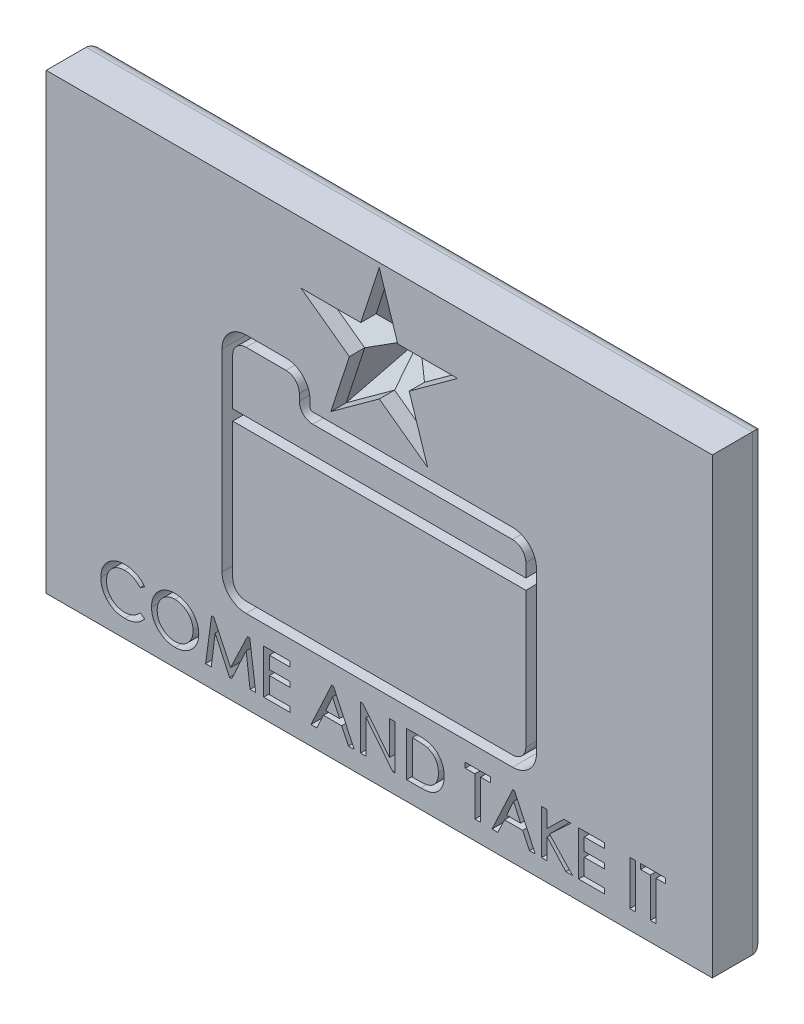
SolidWorks part; units mm, degrees
ref_plane "Front Plane" through (0, 0, 0) normal (0, 0, 1) x (1, 0, 0)
ref_plane "Top Plane" through (0, 0, 0) normal (0, 1, 0) x (1, 0, 0)
ref_plane "Right Plane" through (0, 0, 0) normal (1, 0, 0) x (0, 0, -1)
sketch "Sketch1" plane through (0, 0, 0) normal (0, 0, 1) x (1, 0, 0)
  line L1 (-15.875, -10.795) -> (15.875, -10.795)
  line L2 (-15.875, -10.795) -> (-15.875, 10.795)
  line L3 (-15.875, 10.795) -> (15.875, 10.795)
  line L4 (15.875, -10.795) -> (15.875, 10.795)
  line L5 (-15.875, -10.795) -> (15.875, 10.795) construction
  line L6 (-15.875, 10.795) -> (15.875, -10.795) construction
  point P0 (0, 0)
  dimension "D1" = 31.75
  dimension "D2" = 21.59
extrude "Boss-Extrude1" add sketch "Sketch1" along normal blind 2.54
fillet "Fillet1" radius 0.635 4 edges at (-15.875, 0, 0) (0, -10.795, 0) (0, 10.795, 0) (15.875, 0, 0)
sketch "Sketch2" plane through (0, 0, 2.54) normal (0, 0, 1) x (1, 0, 0)
  line L0 (-15.875, 10.795) -> (-14.977, 9.897) construction
  line L1 (-14.977, 9.897) -> (-14.977, 6.598) construction
  line L2 (-14.977, 6.598) -> (-14.977, 3.299) construction
  line L3 (-14.977, 3.299) -> (-14.977, 0) construction
  line L4 (-14.977, 0) -> (-14.977, -3.299) construction
  line L5 (-14.977, -3.299) -> (-14.977, -6.598) construction
  line L6 (-14.977, -6.598) -> (-14.977, -9.897) construction
  line L7 (-14.977, -9.897) -> (-15.875, -10.795) construction
  line L8 (15.875, 10.795) -> (-15.875, 10.795) construction
  line L9 (-15.875, -10.795) -> (15.875, -10.795) construction
  line L10 (-14.977, -9.897) -> (14.977, -9.897) construction
  line L11 (14.977, -9.897) -> (15.875, -10.795) construction
  line L12 (14.977, -9.897) -> (14.977, -6.598) construction
  line L13 (14.977, -6.598) -> (14.977, -3.299) construction
  line L14 (14.977, -3.299) -> (14.977, 0) construction
  line L15 (14.977, 0) -> (14.977, 3.299) construction
  line L16 (14.977, 3.299) -> (14.977, 6.598) construction
  line L17 (14.977, 6.598) -> (14.977, 9.897) construction
  line L18 (14.977, 9.897) -> (15.875, 10.795) construction
  line L19 (-14.977, 9.897) -> (14.977, 9.897) construction
  line L20 (-14.977, 6.598) -> (14.977, 6.598) construction
  line L21 (-14.977, 3.299) -> (14.977, 3.299) construction
  line L22 (-14.977, 0) -> (14.977, 0) construction
  line L23 (-14.977, -3.299) -> (14.977, -3.299) construction
  line L24 (-14.977, -6.598) -> (14.977, -6.598) construction
  text T0 "<b>COME AND TAKE IT</b>" font "Century Gothic" height in points 8
  dimension "D1" = 45
  dimension "D2" = 45
  dimension "D3" = 1.27
extrude "Cut-Extrude1" cut sketch "Sketch2" against normal blind 1.905
sketch "Sketch3" plane through (0, 0, 2.54) normal (0, 0, 1) x (1, 0, 0)
  line L0 (0, 0) -> (0, -1.905) construction
  line L5 (6.35, 2.54) -> (-3.175, 2.54)
  line L6 (-6.35, -6.35) -> (6.35, -6.35)
  line L7 (-6.985, -5.715) -> (-6.985, 2.54)
  line L9 (6.985, -5.715) -> (6.985, 1.905)
  line L10 (-6.985, -6.35) -> (6.985, 2.54) construction
  line L11 (-6.985, 2.54) -> (6.985, -6.35) construction
  line L12 (-3.81, 3.175) -> (-3.81, 3.4925)
  line L13 (-4.445, 4.1275) -> (-6.35, 4.1275)
  line L14 (-6.985, 3.4925) -> (-6.985, 2.54)
  line L15 (-7.493, -5.715) -> (-7.493, 2.54)
  line L16 (-7.493, 3.4925) -> (-7.493, 2.54)
  line L17 (-4.445, 4.6355) -> (-6.35, 4.6355)
  line L18 (-3.302, 3.175) -> (-3.302, 3.4925)
  line L19 (6.35, 3.048) -> (-3.175, 3.048)
  line L20 (7.493, -5.715) -> (7.493, 1.905)
  line L21 (-6.35, -6.858) -> (6.35, -6.858)
  arc A0 (6.35, 2.54) -> (6.985, 1.905) centre (6.35, 1.905) cw
  arc A1 (6.35, -6.35) -> (6.985, -5.715) centre (6.35, -5.715) ccw
  arc A2 (-6.35, -6.35) -> (-6.985, -5.715) centre (-6.35, -5.715) cw
  arc A3 (-6.35, 4.1275) -> (-6.985, 3.4925) centre (-6.35, 3.4925) ccw
  arc A4 (-3.175, 2.54) -> (-3.81, 3.175) centre (-3.175, 3.175) cw
  arc A5 (-3.81, 3.4925) -> (-4.445, 4.1275) centre (-4.445, 3.4925) ccw
  arc A6 (-6.35, 4.6355) -> (-7.493, 3.4925) centre (-6.35, 3.4925) ccw
  arc A7 (-3.302, 3.4925) -> (-4.445, 4.6355) centre (-4.445, 3.4925) ccw
  arc A8 (-3.175, 3.048) -> (-3.302, 3.175) centre (-3.175, 3.175) cw
  arc A9 (6.35, 3.048) -> (7.493, 1.905) centre (6.35, 1.905) cw
  arc A10 (6.35, -6.858) -> (7.493, -5.715) centre (6.35, -5.715) ccw
  arc A11 (-6.35, -6.858) -> (-7.493, -5.715) centre (-6.35, -5.715) cw
  point P8 (-3.6981, 3.81)
  point P23 (-6.985, 4.1275)
  point P26 (-3.81, 2.54)
  point P29 (-3.81, 4.1275)
  dimension "D7" = 0.635
  dimension "D8" = 0.635
  dimension "D1" = 1.905
  dimension "D2" = 8.89
  dimension "D3" = 13.97
  dimension "D4" = 3.175
  dimension "D5" = 10.795
  dimension "D6" = 1.5875
  dimension "D9" = 0.508
extrude "Cut-Extrude2" cut sketch "Sketch3" against normal blind 1.905
sketch "Sketch4" plane through (0, 0, 2.54) normal (0, 0, 1) x (1, 0, 0)
  line L0 (-6.985, 3.4925) -> (-6.985, -5.715) construction
  line L1 (-6.985, 1.27) -> (6.985, 1.27)
  line L2 (-6.985, 1.27) -> (-6.985, 0.762)
  line L3 (-6.985, 0.762) -> (6.985, 0.762)
  line L4 (6.985, 1.27) -> (6.985, 0.762)
  line L5 (6.985, -5.715) -> (6.985, 1.905) construction
  line L6 (0, 1.27) -> (0, 2.54) construction
  line L7 (6.35, 2.54) -> (-3.175, 2.54) construction
  dimension "D1" = 0.508
  dimension "D2" = 1.27
extrude "Cut-Extrude3" cut sketch "Sketch4" against normal blind 1.905
sketch "Sketch5" plane through (0, 0, 2.54) normal (0, 0, 1) x (1, 0, 0)
  line L0 (0, 1.27) -> (0, 6.6675) construction
  line L1 (0, 10.592) -> (-3.7324, 7.8802) construction
  line L2 (-3.7324, 7.8802) -> (-2.3068, 3.4925) construction
  line L3 (-2.3068, 3.4925) -> (2.3068, 3.4925) construction
  line L4 (2.3068, 3.4925) -> (3.7324, 7.8802) construction
  line L5 (3.7324, 7.8802) -> (0, 10.592) construction
  line L6 (6.985, 1.27) -> (-6.985, 1.27) construction
  line L7 (-0.8811, 7.8802) -> (0, 10.592)
  line L8 (0, 10.592) -> (0.8811, 7.8802)
  line L9 (0.8811, 7.8802) -> (3.7324, 7.8802)
  line L10 (3.7324, 7.8802) -> (1.4257, 6.2043)
  line L11 (1.4257, 6.2043) -> (2.3068, 3.4925)
  line L12 (2.3068, 3.4925) -> (0, 5.1685)
  line L13 (0, 5.1685) -> (-2.3068, 3.4925)
  line L14 (-2.3068, 3.4925) -> (-1.4257, 6.2043)
  line L15 (-1.4257, 6.2043) -> (-3.7324, 7.8802)
  line L16 (-3.7324, 7.8802) -> (-0.8811, 7.8802)
  line L17 (0, 5.1685) -> (0, 6.6675) construction
  line L18 (-1.4257, 6.2043) -> (0, 6.6675) construction
  line L19 (0, 6.6675) -> (1.4257, 6.2043) construction
  line L20 (0, 6.6675) -> (0.8811, 7.8802) construction
  line L21 (0, 6.6675) -> (-0.8811, 7.8802) construction
  circle A0 centre (0, 6.6675) radius 3.175 construction
  point P15 (-0.8748, 7.8802)
  point P16 (0.8811, 7.8802)
  point P17 (0.8811, 7.8802)
  point P18 (-0.8811, 7.8802)
  dimension "D1" = 6.35
  dimension "D2" = 5.3975
  dimension "D3" = 72
  dimension "D4" = 72
  dimension "D5" = 72
  dimension "D6" = 72
extrude "Cut-Extrude4" cut sketch "Sketch5" against normal blind 1.905
chamfer "Chamfer1" distance 1.1747 angle 45 10 edges at (-2.3068, 7.8802, 0.635) (-0.4406, 9.2361, 0.635) (0.4406, 9.2361, 0.635) (2.3068, 7.8802, 0.635) (2.5791, 7.0423, 0.635) (1.8662, 4.8484, 0.635) (1.1534, 4.3305, 0.635) (-1.1534, 4.3305, 0.635) (-1.8662, 4.8484, 0.635) (-2.5791, 7.0423, 0.635)
